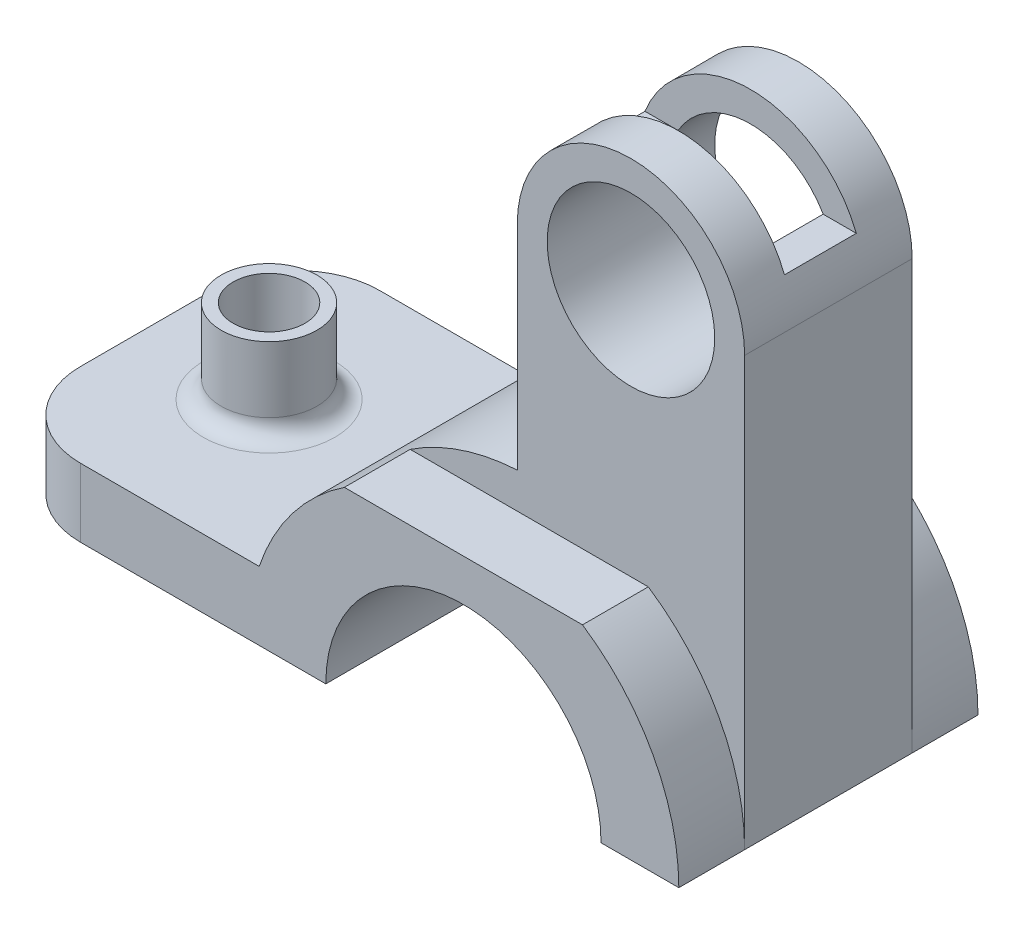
SolidWorks part; units mm, degrees
ref_plane "Front Plane" through (0, 0, 0) normal (0, 0, 1) x (1, 0, 0)
ref_plane "Top Plane" through (0, 0, 0) normal (0, 1, 0) x (1, 0, 0)
ref_plane "Right Plane" through (0, 0, 0) normal (1, 0, 0) x (0, 0, -1)
sketch "Sketch1" plane through (0, 0, 0) normal (0, 0, 1) x (1, 0, 0)
  line L0 (-36, 0) -> (-78, 0)
  line L1 (-78, 0) -> (-78, 11.4412)
  line L2 (-78, 11.4412) -> (-34.1335, 11.4412)
  line L3 (-36, 0) -> (-23, 0) construction
  line L4 (-36, 0) -> (-23, 0)
  line L5 (23, 0) -> (36, 0)
  arc A0 (23, 0) -> (-23, 0) centre (0, 0) ccw
  arc A1 (36, 0) -> (-34.1335, 11.4412) centre (0, 0) ccw
  dimension "D1" = 46
  dimension "D2" = 72
  dimension "D3" = 11.4412
  dimension "D4" = 114
extrude "Boss-Extrude1" add sketch "Sketch1" along normal mid plane 50
sketch "Sketch2" plane through (0, 0, 0) normal (0, 0, 1) x (1, 0, 0)
  line L0 (36, 0) -> (36, 72)
  line L1 (-2, 71.5473) -> (-2, 35.9444)
  arc A0 (36, 71.5473) -> (-2, 71.5473) centre (17, 71.5473) ccw
  circle A1 centre (17, 71.5473) radius 14
  arc A2 (36, 0) -> (-34.1335, 11.4412) centre (0, 0) ccw construction
  arc A3 (-2, 35.9444) -> (36, 0) centre (0, 0) cw
  dimension "D1" = 38
  dimension "D2" = 28
  dimension "D3" = 72
extrude "Boss-Extrude2" add sketch "Sketch2" along normal mid plane 28 contours L1 A3 L0 A0 A1
sketch "Sketch3" plane through (0, 0, 25) normal (0, 0, 1) x (1, 0, 0)
  line L5 (-33.967, 46.7422) -> (43.8443, 46.7422)
  line L6 (-33.967, 46.7422) -> (-33.967, 30)
  line L7 (-33.967, 30) -> (43.8443, 30)
  line L8 (43.8443, 46.7422) -> (43.8443, 30)
  dimension "D1" = 30
extrude "Cut-Extrude1" cut sketch "Sketch3" against normal blind 11
sketch "Sketch5" plane through (0, 0, -25) normal (0, 0, -1) x (-1, 0, 0)
  line L1 (-49.7403, 45.0209) -> (28.9489, 45.0209)
  line L2 (-49.7403, 45.0209) -> (-49.7403, 30)
  line L3 (-49.7403, 30) -> (28.9489, 30)
  line L4 (28.9489, 45.0209) -> (28.9489, 30)
  dimension "D1" = 30
extrude "Cut-Extrude2" cut sketch "Sketch5" against normal blind 11
sketch "Sketch6" plane through (0, 11.4412, 0) normal (0, 1, 0) x (1, 0, 0)
  circle A0 centre (-57.4853, 0) radius 8
  dimension "D1" = 16
extrude "Boss-Extrude3" add sketch "Sketch6" along normal blind 14
sketch "Sketch7" plane through (0, 25.4412, 0) normal (0, 1, 0) x (1, 0, 0)
  circle A0 centre (-57.4853, 0) radius 6
  dimension "D1" = 12
extrude "Cut-Extrude3" cut sketch "Sketch7" against normal blind 30
fillet "Fillet1" radius 14 2 edges at (-78, 5.7206, -25) (-78, 5.7206, 25)
fillet "Fillet2" radius 3 1 edges at (-49.4853, 11.4412, 0)
sketch "Sketch8" plane through (36, 0, 0) normal (1, 0, 0) x (0, 0, -1)
  line L0 (14, 90.5473) -> (-14, 90.5473) construction
  line L1 (-6, 90.5473) -> (6, 90.5473)
  line L2 (-6, 90.5473) -> (-6, 78.5473)
  line L3 (-6, 78.5473) -> (6, 78.5473)
  line L4 (6, 90.5473) -> (6, 78.5473)
  dimension "D1" = 12
  dimension "D2" = 12
  dimension "D3" = 8
extrude "Cut-Extrude4" cut sketch "Sketch8" against normal blind 41
